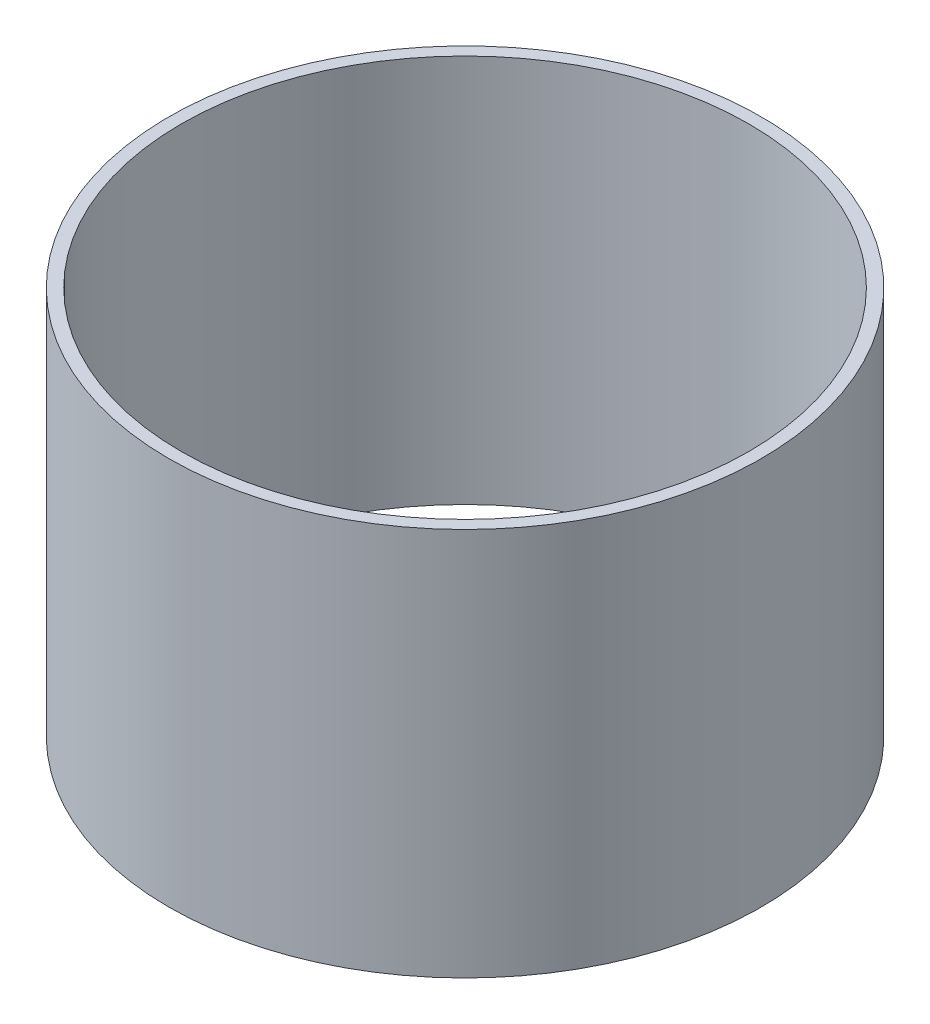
SolidWorks part; units mm, degrees
ref_plane "Front Plane" through (0, 0, 0) normal (0, 0, 1) x (1, 0, 0)
ref_plane "Top Plane" through (0, 0, 0) normal (0, 1, 0) x (1, 0, 0)
ref_plane "Right Plane" through (0, 0, 0) normal (1, 0, 0) x (0, 0, -1)
sketch "Sketch1" plane through (0, 0, 0) normal (0, 1, 0) x (1, 0, 0)
  circle A0 centre (0, 0) radius 152.4
  circle A1 centre (0, 0) radius 146.05
  dimension "D1" = 6.35
  dimension "D2" = 304.8
extrude "Extrude1" add sketch "Sketch1" along normal blind 199.898
